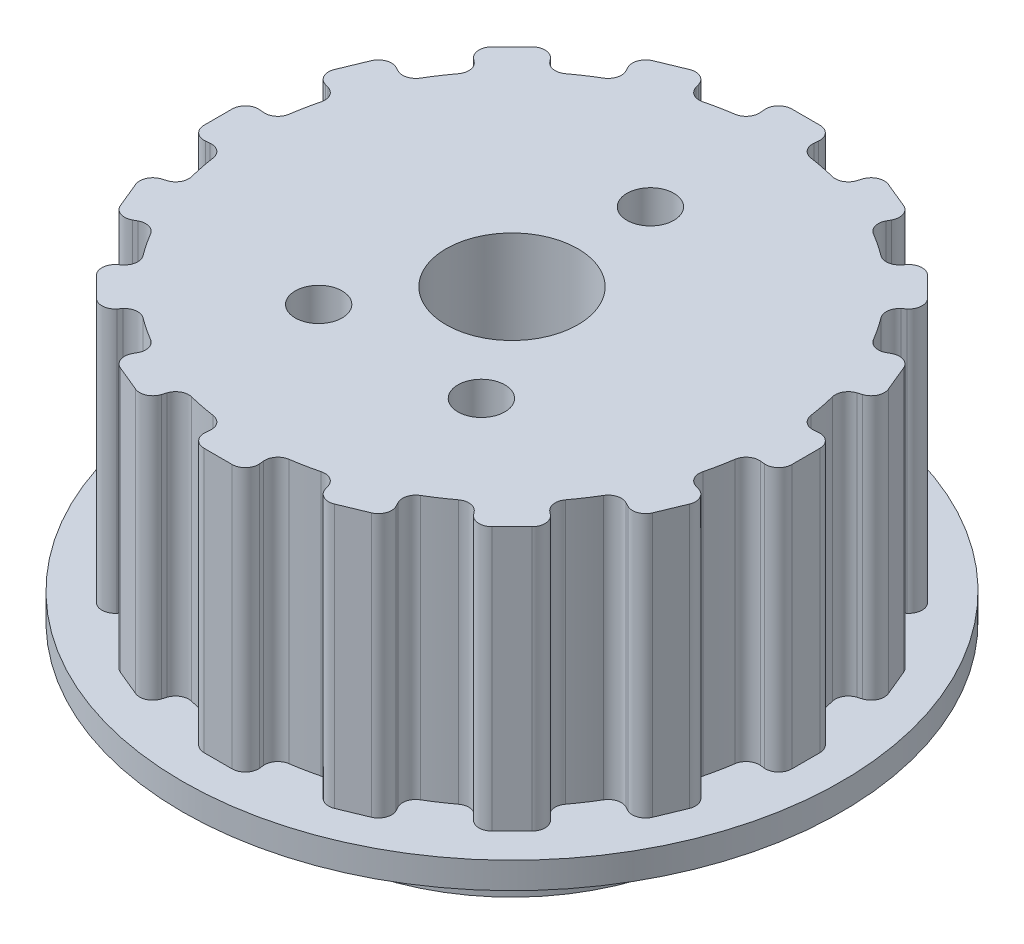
SolidWorks part; units mm, degrees
ref_plane "Front Plane" through (0, 0, 0) normal (0, 0, 1) x (1, 0, 0)
ref_plane "Top Plane" through (0, 0, 0) normal (0, 1, 0) x (1, 0, 0)
ref_plane "Right Plane" through (0, 0, 0) normal (1, 0, 0) x (0, 0, -1)
sketch "Sketch1" plane through (0, 0, 0) normal (0, 1, 0) x (1, 0, 0)
  line L0 (-0.6746, 14.1553) -> (0.6746, 14.1553)
  line L1 (1.3067, 13.4589) -> (1.2871, 13.2575)
  line L2 (-1.3067, 13.4589) -> (-1.2871, 13.2575)
  line L3 (4.7937, 13.336) -> (6.0403, 12.8196)
  line L4 (3.9433, 12.9345) -> (3.8843, 12.7409)
  line L5 (6.3577, 11.9344) -> (6.2626, 11.7558)
  line L6 (9.5323, 10.4863) -> (10.4863, 9.5323)
  line L7 (8.593, 10.4408) -> (8.4644, 10.2846)
  line L8 (10.4408, 8.593) -> (10.2846, 8.4644)
  line L9 (12.8196, 6.0403) -> (13.336, 4.7937)
  line L10 (11.9344, 6.3577) -> (11.7558, 6.2626)
  line L11 (12.9345, 3.9433) -> (12.7409, 3.8843)
  line L12 (14.1553, 0.6746) -> (14.1553, -0.6746)
  line L13 (13.4589, 1.3067) -> (13.2575, 1.2871)
  line L14 (13.4589, -1.3067) -> (13.2575, -1.2871)
  line L15 (13.336, -4.7937) -> (12.8196, -6.0403)
  line L16 (12.9345, -3.9433) -> (12.7409, -3.8843)
  line L17 (11.9344, -6.3577) -> (11.7558, -6.2626)
  line L18 (10.4863, -9.5323) -> (9.5323, -10.4863)
  line L19 (10.4408, -8.593) -> (10.2846, -8.4644)
  line L20 (8.593, -10.4408) -> (8.4644, -10.2846)
  line L21 (6.0403, -12.8196) -> (4.7937, -13.336)
  line L22 (6.3577, -11.9344) -> (6.2626, -11.7558)
  line L23 (3.9433, -12.9345) -> (3.8843, -12.7409)
  line L24 (0.6746, -14.1553) -> (-0.6746, -14.1553)
  line L25 (1.3067, -13.4589) -> (1.2871, -13.2575)
  line L26 (-1.3067, -13.4589) -> (-1.2871, -13.2575)
  line L27 (-4.7937, -13.336) -> (-6.0403, -12.8196)
  line L28 (-3.9433, -12.9345) -> (-3.8843, -12.7409)
  line L29 (-6.3577, -11.9344) -> (-6.2626, -11.7558)
  line L30 (-9.5323, -10.4863) -> (-10.4863, -9.5323)
  line L31 (-8.593, -10.4408) -> (-8.4644, -10.2846)
  line L32 (-10.4408, -8.593) -> (-10.2846, -8.4644)
  line L33 (-12.8196, -6.0403) -> (-13.336, -4.7937)
  line L34 (-11.9344, -6.3577) -> (-11.7558, -6.2626)
  line L35 (-12.9345, -3.9433) -> (-12.7409, -3.8843)
  line L36 (-14.1553, -0.6746) -> (-14.1553, 0.6746)
  line L37 (-13.4589, -1.3067) -> (-13.2575, -1.2871)
  line L38 (-13.4589, 1.3067) -> (-13.2575, 1.2871)
  line L39 (-13.336, 4.7937) -> (-12.8196, 6.0403)
  line L40 (-12.9345, 3.9433) -> (-12.7409, 3.8843)
  line L41 (-11.9344, 6.3577) -> (-11.7558, 6.2626)
  line L42 (-10.4863, 9.5323) -> (-9.5323, 10.4863)
  line L43 (-10.4408, 8.593) -> (-10.2846, 8.4644)
  line L44 (-8.593, 10.4408) -> (-8.4644, 10.2846)
  line L45 (-6.0403, 12.8196) -> (-4.7937, 13.336)
  line L46 (-6.3577, 11.9344) -> (-6.2626, 11.7558)
  line L47 (-3.9433, 12.9345) -> (-3.8843, 12.7409)
  arc A0 (-1.8277, 12.5678) -> (-3.1209, 12.3106) centre (0, 0) ccw
  arc A1 (1.2272, 12.6406) -> (-1.2272, 12.6406) centre (0, 0) ccw construction
  arc A2 (0.6746, 14.1553) -> (1.3067, 13.4589) centre (0.6746, 13.5203) cw
  arc A3 (-0.6746, 14.1553) -> (-1.3067, 13.4589) centre (-0.6746, 13.5203) ccw
  arc A4 (-1.2871, 13.2575) -> (-1.8277, 12.5678) centre (-1.9191, 13.1962) cw
  arc A5 (1.2871, 13.2575) -> (1.8277, 12.5678) centre (1.9191, 13.1962) ccw
  arc A6 (4.7937, 13.336) -> (3.9433, 12.9345) centre (4.5507, 12.7493) ccw
  arc A7 (3.8843, 12.7409) -> (3.1209, 12.3106) centre (3.2769, 12.9261) cw
  arc A8 (6.2626, 11.7558) -> (6.4981, 10.9117) centre (6.823, 11.4573) ccw
  arc A9 (6.0403, 12.8196) -> (6.3577, 11.9344) centre (5.7973, 12.2329) cw
  arc A10 (9.5323, 10.4863) -> (8.593, 10.4408) centre (9.0833, 10.0373) ccw
  arc A11 (8.4644, 10.2846) -> (7.5944, 10.1792) centre (7.9741, 10.6881) cw
  arc A12 (10.2846, 8.4644) -> (10.1792, 7.5944) centre (10.6881, 7.9741) ccw
  arc A13 (10.4863, 9.5323) -> (10.4408, 8.593) centre (10.0373, 9.0833) cw
  arc A14 (12.8196, 6.0403) -> (11.9344, 6.3577) centre (12.2329, 5.7973) ccw
  arc A15 (11.7558, 6.2626) -> (10.9117, 6.4981) centre (11.4573, 6.823) cw
  arc A16 (12.7409, 3.8843) -> (12.3106, 3.1209) centre (12.9261, 3.2769) ccw
  arc A17 (13.336, 4.7937) -> (12.9345, 3.9433) centre (12.7493, 4.5507) cw
  arc A18 (14.1553, 0.6746) -> (13.4589, 1.3067) centre (13.5203, 0.6746) ccw
  arc A19 (13.2575, 1.2871) -> (12.5678, 1.8277) centre (13.1962, 1.9191) cw
  arc A20 (13.2575, -1.2871) -> (12.5678, -1.8277) centre (13.1962, -1.9191) ccw
  arc A21 (14.1553, -0.6746) -> (13.4589, -1.3067) centre (13.5203, -0.6746) cw
  arc A22 (13.336, -4.7937) -> (12.9345, -3.9433) centre (12.7493, -4.5507) ccw
  arc A23 (12.7409, -3.8843) -> (12.3106, -3.1209) centre (12.9261, -3.2769) cw
  arc A24 (11.7558, -6.2626) -> (10.9117, -6.4981) centre (11.4573, -6.823) ccw
  arc A25 (12.8196, -6.0403) -> (11.9344, -6.3577) centre (12.2329, -5.7973) cw
  arc A26 (10.4863, -9.5323) -> (10.4408, -8.593) centre (10.0373, -9.0833) ccw
  arc A27 (10.2846, -8.4644) -> (10.1792, -7.5944) centre (10.6881, -7.9741) cw
  arc A28 (8.4644, -10.2846) -> (7.5944, -10.1792) centre (7.9741, -10.6881) ccw
  arc A29 (9.5323, -10.4863) -> (8.593, -10.4408) centre (9.0833, -10.0373) cw
  arc A30 (6.0403, -12.8196) -> (6.3577, -11.9344) centre (5.7973, -12.2329) ccw
  arc A31 (6.2626, -11.7558) -> (6.4981, -10.9117) centre (6.823, -11.4573) cw
  arc A32 (3.8843, -12.7409) -> (3.1209, -12.3106) centre (3.2769, -12.9261) ccw
  arc A33 (4.7937, -13.336) -> (3.9433, -12.9345) centre (4.5507, -12.7493) cw
  arc A34 (0.6746, -14.1553) -> (1.3067, -13.4589) centre (0.6746, -13.5203) ccw
  arc A35 (1.2871, -13.2575) -> (1.8277, -12.5678) centre (1.9191, -13.1962) cw
  arc A36 (-1.2871, -13.2575) -> (-1.8277, -12.5678) centre (-1.9191, -13.1962) ccw
  arc A37 (-0.6746, -14.1553) -> (-1.3067, -13.4589) centre (-0.6746, -13.5203) cw
  arc A38 (-4.7937, -13.336) -> (-3.9433, -12.9345) centre (-4.5507, -12.7493) ccw
  arc A39 (-3.8843, -12.7409) -> (-3.1209, -12.3106) centre (-3.2769, -12.9261) cw
  arc A40 (-6.2626, -11.7558) -> (-6.4981, -10.9117) centre (-6.823, -11.4573) ccw
  arc A41 (-6.0403, -12.8196) -> (-6.3577, -11.9344) centre (-5.7973, -12.2329) cw
  arc A42 (-9.5323, -10.4863) -> (-8.593, -10.4408) centre (-9.0833, -10.0373) ccw
  arc A43 (-8.4644, -10.2846) -> (-7.5944, -10.1792) centre (-7.9741, -10.6881) cw
  arc A44 (-10.2846, -8.4644) -> (-10.1792, -7.5944) centre (-10.6881, -7.9741) ccw
  arc A45 (-10.4863, -9.5323) -> (-10.4408, -8.593) centre (-10.0373, -9.0833) cw
  arc A46 (-12.8196, -6.0403) -> (-11.9344, -6.3577) centre (-12.2329, -5.7973) ccw
  arc A47 (-11.7558, -6.2626) -> (-10.9117, -6.4981) centre (-11.4573, -6.823) cw
  arc A48 (-12.7409, -3.8843) -> (-12.3106, -3.1209) centre (-12.9261, -3.2769) ccw
  arc A49 (-13.336, -4.7937) -> (-12.9345, -3.9433) centre (-12.7493, -4.5507) cw
  arc A50 (-14.1553, -0.6746) -> (-13.4589, -1.3067) centre (-13.5203, -0.6746) ccw
  arc A51 (-13.2575, -1.2871) -> (-12.5678, -1.8277) centre (-13.1962, -1.9191) cw
  arc A52 (-13.2575, 1.2871) -> (-12.5678, 1.8277) centre (-13.1962, 1.9191) ccw
  arc A53 (-14.1553, 0.6746) -> (-13.4589, 1.3067) centre (-13.5203, 0.6746) cw
  arc A54 (-13.336, 4.7937) -> (-12.9345, 3.9433) centre (-12.7493, 4.5507) ccw
  arc A55 (-12.7409, 3.8843) -> (-12.3106, 3.1209) centre (-12.9261, 3.2769) cw
  arc A56 (-11.7558, 6.2626) -> (-10.9117, 6.4981) centre (-11.4573, 6.823) ccw
  arc A57 (-12.8196, 6.0403) -> (-11.9344, 6.3577) centre (-12.2329, 5.7973) cw
  arc A58 (-10.4863, 9.5323) -> (-10.4408, 8.593) centre (-10.0373, 9.0833) ccw
  arc A59 (-10.2846, 8.4644) -> (-10.1792, 7.5944) centre (-10.6881, 7.9741) cw
  arc A60 (-8.4644, 10.2846) -> (-7.5944, 10.1792) centre (-7.9741, 10.6881) ccw
  arc A61 (-9.5323, 10.4863) -> (-8.593, 10.4408) centre (-9.0833, 10.0373) cw
  arc A62 (-6.0403, 12.8196) -> (-6.3577, 11.9344) centre (-5.7973, 12.2329) ccw
  arc A63 (-6.2626, 11.7558) -> (-6.4981, 10.9117) centre (-6.823, 11.4573) cw
  arc A64 (-3.8843, 12.7409) -> (-3.1209, 12.3106) centre (-3.2769, 12.9261) ccw
  arc A65 (-4.7937, 13.336) -> (-3.9433, 12.9345) centre (-4.5507, 12.7493) cw
  arc A66 (-7.5944, 10.1792) -> (-10.1792, 7.5944) centre (0, 0) ccw construction
  arc A67 (-10.1792, 7.5944) -> (-10.9117, 6.4981) centre (0, 0) ccw
  arc A68 (-3.1209, 12.3106) -> (-6.4981, 10.9117) centre (0, 0) ccw construction
  arc A69 (-6.4981, 10.9117) -> (-7.5944, 10.1792) centre (0, 0) ccw
  arc A70 (6.4981, 10.9117) -> (3.1209, 12.3106) centre (0, 0) ccw construction
  arc A71 (3.1209, 12.3106) -> (1.8277, 12.5678) centre (0, 0) ccw
  arc A72 (10.1792, 7.5944) -> (7.5944, 10.1792) centre (0, 0) ccw construction
  arc A73 (7.5944, 10.1792) -> (6.4981, 10.9117) centre (0, 0) ccw
  arc A74 (12.3106, 3.1209) -> (10.9117, 6.4981) centre (0, 0) ccw construction
  arc A75 (10.9117, 6.4981) -> (10.1792, 7.5944) centre (0, 0) ccw
  arc A76 (12.5678, -1.8277) -> (12.5678, 1.8277) centre (0, 0) ccw construction
  arc A77 (12.5678, 1.8277) -> (12.3106, 3.1209) centre (0, 0) ccw
  arc A78 (10.9117, -6.4981) -> (12.3106, -3.1209) centre (0, 0) ccw construction
  arc A79 (12.3106, -3.1209) -> (12.5678, -1.8277) centre (0, 0) ccw
  arc A80 (7.5944, -10.1792) -> (10.1792, -7.5944) centre (0, 0) ccw construction
  arc A81 (10.1792, -7.5944) -> (10.9117, -6.4981) centre (0, 0) ccw
  arc A82 (3.1209, -12.3106) -> (6.4981, -10.9117) centre (0, 0) ccw construction
  arc A83 (6.4981, -10.9117) -> (7.5944, -10.1792) centre (0, 0) ccw
  arc A84 (-1.8277, -12.5678) -> (1.8277, -12.5678) centre (0, 0) ccw construction
  arc A85 (1.8277, -12.5678) -> (3.1209, -12.3106) centre (0, 0) ccw
  arc A86 (-10.1792, -7.5944) -> (-7.5944, -10.1792) centre (0, 0) ccw construction
  arc A87 (-7.5944, -10.1792) -> (-6.4981, -10.9117) centre (0, 0) ccw
  arc A88 (-6.4981, -10.9117) -> (-3.1209, -12.3106) centre (0, 0) ccw construction
  arc A89 (-3.1209, -12.3106) -> (-1.8277, -12.5678) centre (0, 0) ccw
  arc A90 (-12.3106, -3.1209) -> (-10.9117, -6.4981) centre (0, 0) ccw construction
  arc A91 (-10.9117, -6.4981) -> (-10.1792, -7.5944) centre (0, 0) ccw
  arc A92 (-12.5678, 1.8277) -> (-12.5678, -1.8277) centre (0, 0) ccw construction
  arc A93 (-12.5678, -1.8277) -> (-12.3106, -3.1209) centre (0, 0) ccw
  arc A94 (-10.9117, 6.4981) -> (-12.3106, 3.1209) centre (0, 0) ccw construction
  arc A95 (-12.3106, 3.1209) -> (-12.5678, 1.8277) centre (0, 0) ccw
  circle A96 centre (0, 0) radius 3.175
  point P5 (0, 14.1553)
  point P8 (0, 14.1553)
  point P201 (0, 0)
  dimension "D1" = 0.635
  dimension "D4" = 12.7
  dimension "D5" = 6.35
  dimension "D2" = 1.5875
  dimension "D3" = 16
extrude "Boss-Extrude1" add sketch "Sketch1" along normal blind 12.7
sketch "Sketch3" plane through (0, 0, 0) normal (0, -1, 0) x (1, 0, 0)
  circle A0 centre (0, 0) radius 15.875
  circle A1 centre (0, 0) radius 3.175 construction
  circle A2 centre (0, 0) radius 3.175
  dimension "D1" = 31.75
extrude "Boss-Extrude3" add sketch "Sketch3" along normal blind 1.27
sketch "Sketch2" plane through (0, -1.27, 0) normal (0, -1, 0) x (1, 0, 0)
  circle A0 centre (0, 0) radius 9.525
  circle A3 centre (0, 0) radius 3.175 construction
  circle A4 centre (0, 0) radius 3.175
  dimension "D1" = 19.05
extrude "Boss-Extrude2" add sketch "Sketch2" along normal blind 4.7625
sketch "Sketch4" plane through (0, 12.7, 0) normal (0, 1, 0) x (1, 0, 0)
  circle A0 centre (0, 0) radius 6.35
  circle A1 centre (0, 0) radius 3.175 construction
  circle A2 centre (0, 0) radius 3.175
  dimension "D1" = 12.7
extrude "Boss-Extrude4" [suppressed] add sketch "Sketch4" along normal blind 1.5875
sketch "Sketch5" [suppressed] plane through (0, 12.7, 0) normal (0, 1, 0) x (1, 0, 0)
  circle A0 centre (0, 0) radius 6.35
  circle A1 centre (0, 0) radius 15.875
  circle A3 centre (0, 0) radius 15.875 construction
  circle A4 centre (0, 0) radius 6.35 construction
extrude "Boss-Extrude5" [suppressed] add sketch "Sketch5" along normal blind 1.27 separate body
sketch "Sketch6" plane through (0, 0, 0) normal (1, 0, 0) x (0, 0, -1)
  line L0 (0, -6.0325) -> (0, -1.27) construction
  line L1 (-9.525, -6.0325) -> (9.525, -6.0325) construction
  line L2 (-9.525, -1.27) -> (9.525, -1.27) construction
  circle A0 centre (0, -3.6513) radius 0.9922
  dimension "D1" = 1.9844
extrude "Cut-Extrude1" cut sketch "Sketch6" against normal through all both and the other way through all
sketch "Sketch7" plane through (0, 12.7, 0) normal (0, 1, 0) x (1, 0, 0)
  circle A0 centre (0, 0) radius 6.6675 construction
  circle A1 centre (0, 6.6675) radius 1.1303
  circle A2 centre (6.3412, 2.0604) radius 1.1303 construction
  circle A3 centre (0, 0) radius 6.6675 construction
  circle A4 centre (3.9191, -5.3941) radius 1.1303
  circle A5 centre (0, 0) radius 6.6675 construction
  circle A6 centre (-3.9191, -5.3941) radius 1.1303
  circle A7 centre (0, 0) radius 6.6675 construction
  circle A8 centre (-6.3412, 2.0604) radius 1.1303 construction
  circle A9 centre (0, 0) radius 6.6675 construction
  point P19 (0, 0)
  dimension "D1" = 13.335
  dimension "D2" = 2.2606
  dimension "D3" = 5
extrude "Cut-Extrude2" cut sketch "Sketch7" against normal blind 5.588
